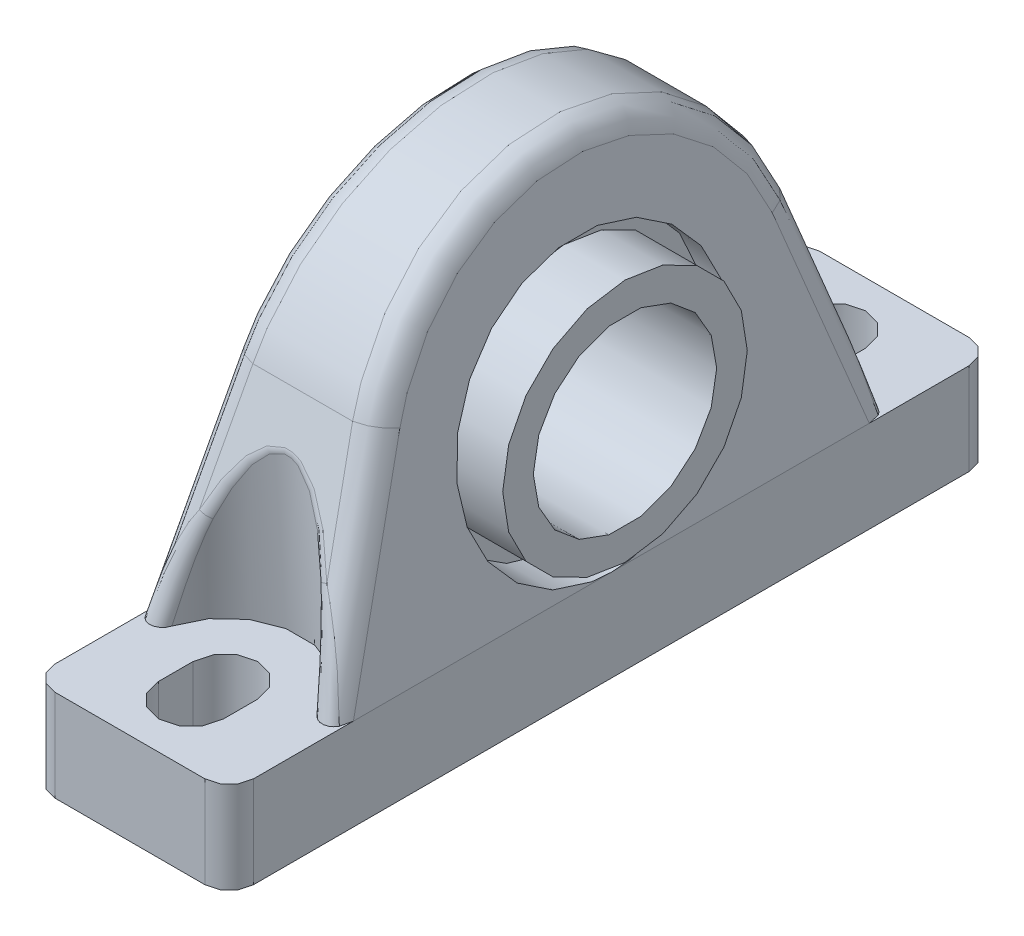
SolidWorks part; units mm, degrees
ref_plane "front" through (0, 0, 0) normal (0, 0, 1) x (1, 0, 0)
ref_plane "top" through (0, 0, 0) normal (0, 1, 0) x (1, 0, 0)
ref_plane "side" through (0, 0, 0) normal (1, 0, 0) x (0, 0, -1)
sketch "Sketch1" plane through (0, 0, 0) normal (1, 0, 0) x (0, 0, -1)
  line L0 (0, 0) -> (0, 89.4558) construction
  line L1 (-79.375, 0) -> (79.375, 0)
  line L2 (79.375, 0) -> (79.375, 19.05)
  line L3 (79.375, 19.05) -> (58.7375, 19.05)
  line L4 (58.7375, 19.05) -> (43.4651, 62.7985)
  line L5 (-58.7375, 19.05) -> (-43.4651, 62.7985)
  line L6 (-79.375, 19.05) -> (-58.7375, 19.05)
  line L7 (-79.375, 0) -> (-79.375, 19.05)
  arc A0 (43.4651, 62.7985) -> (-43.4651, 62.7985) centre (0, 47.625) ccw
  point P12 (0, 0)
  dimension "D1" = 158.75
  dimension "D2" = 93.6625
  dimension "D3" = 47.625
  dimension "D4" = 19.05
  dimension "D5" = 117.475
extrude "Base-Extrude" add sketch "Sketch1" along normal mid plane 41.275
sketch "Sketch3" plane through (0, 0, 79.375) normal (0, 0, 1) x (1, 0, 0)
  line L0 (20.6375, 19.05) -> (11.4762, 93.6625)
  line L1 (20.6375, 93.6625) -> (-20.6375, 93.6625) construction
  line L2 (11.4762, 93.6625) -> (20.6375, 93.6625)
  line L3 (20.6375, 62.7985) -> (20.6375, 93.6625) construction
  line L4 (20.6375, 93.6625) -> (20.6375, 19.05)
  dimension "D1" = 7
extrude "Cut-Extrude1" cut sketch "Sketch3" against normal through all
mirror "Mirror1" about plane through (0, 0, 0) normal (1, 0, 0) of "Cut-Extrude1"
sketch "Sketch4" plane through (0, 0, 0) normal (1, 0, 0) x (0, 0, -1)
  circle A0 centre (0, 47.625) radius 25.4
  dimension "D1" = 50.8
extrude "Boss-Extrude2" add sketch "Sketch4" along normal blind 23.4696
sketch "Sketch5" plane through (23.4696, 0, 0) normal (1, 0, 0) x (0, 0, -1)
  circle A0 centre (0, 47.625) radius 28.575
  circle A1 centre (0, 47.625) radius 25.4
  circle A2 centre (0, 47.625) radius 25.4
  dimension "D2" = 57.15
  dimension "D1" = 0
extrude "Cut-Extrude2" cut sketch "Sketch5" against normal blind 12.7
sketch "Sketch6" plane through (23.4696, 0, 0) normal (1, 0, 0) x (0, 0, -1)
  circle A0 centre (0, 47.625) radius 19.05
  dimension "D1" = 38.1
extrude "Cut-Extrude3" cut sketch "Sketch6" against normal through all
sketch "Sketch7" plane through (-20.6375, 0, 0) normal (-1, 0, 0) x (0, 0, 1)
  circle A0 centre (0, 47.625) radius 25.4 construction
  arc A1 (28.575, 47.625) -> (28.575, 47.625) centre (0, 47.625) ccw
  circle A2 centre (0, 47.625) radius 28.575
  circle A3 centre (0, 47.625) radius 25.4
  dimension "D1" = 0
extrude "Cut-Extrude4" cut sketch "Sketch7" against normal blind 9.525
sketch "Sketch8" plane through (0, 0, 0) normal (0, -1, 0) x (1, 0, 0)
  line L0 (0, -79.375) -> (0, 79.375) construction
  line L1 (20.6375, -79.375) -> (-20.6375, -79.375) construction
  line L2 (20.6375, 79.375) -> (-20.6375, 79.375) construction
  line L3 (6.7437, -59.5312) -> (6.7437, -66.675)
  line L4 (-6.7437, -59.5312) -> (-6.7437, -66.675)
  line L5 (0, 0) -> (43.4591, 0) construction
  line L6 (-6.7437, 59.5312) -> (-6.7437, 66.675)
  line L7 (6.7437, 59.5312) -> (6.7437, 66.675)
  arc A0 (6.7437, -66.675) -> (-6.7437, -66.675) centre (0, -66.675) cw
  arc A1 (6.7437, -59.5312) -> (-6.7437, -59.5312) centre (0, -59.5312) ccw
  arc A3 (6.7437, 59.5312) -> (-6.7437, 59.5312) centre (0, 59.5312) cw
  arc A5 (6.7437, 66.675) -> (-6.7437, 66.675) centre (0, 66.675) ccw
  dimension "D1" = 119.0625
  dimension "D2" = 133.35
  dimension "D3" = 13.4874
extrude "Cut-Extrude5" cut sketch "Sketch8" against normal through all
sketch "Sketch9" plane through (0, 19.05, 0) normal (0, 1, 0) x (-1, 0, 0)
  circle A0 centre (0, 59.5313) radius 15.875
  circle A2 centre (0, -59.5312) radius 15.875
  dimension "D1" = 31.75
extrude "Cut-Extrude6" cut sketch "Sketch9" along normal through all draft 5
fillet "Fillet1" radius 5.08 16 edges at (-20.6375, 9.525, -79.375) (-18.2463, 19.05, 58.7375) (0, 53.5938, 46.6784) (-18.2463, 19.05, -58.7375) (0, 53.5938, -46.6784) (18.2463, 19.05, 58.7375) (18.2463, 19.05, -58.7375) (20.6375, 9.525, 79.375) (17.9517, 40.9242, 51.1013) (17.9517, 40.9242, -51.1013) (11.4762, 93.6625, 0) (20.6375, 9.525, -79.375) (-17.9517, 40.9242, -51.1013) (-11.4762, 93.6625, 0) (-17.9517, 40.9242, 51.1013) (-20.6375, 9.525, 79.375)
fillet "Fillet3" radius 2.54 8 edges at (0, 53.5938, -46.6784) (0, 53.5938, 46.6784) (19.2552, 19.05, -57.1894) (-19.2552, 19.05, 57.1894)
